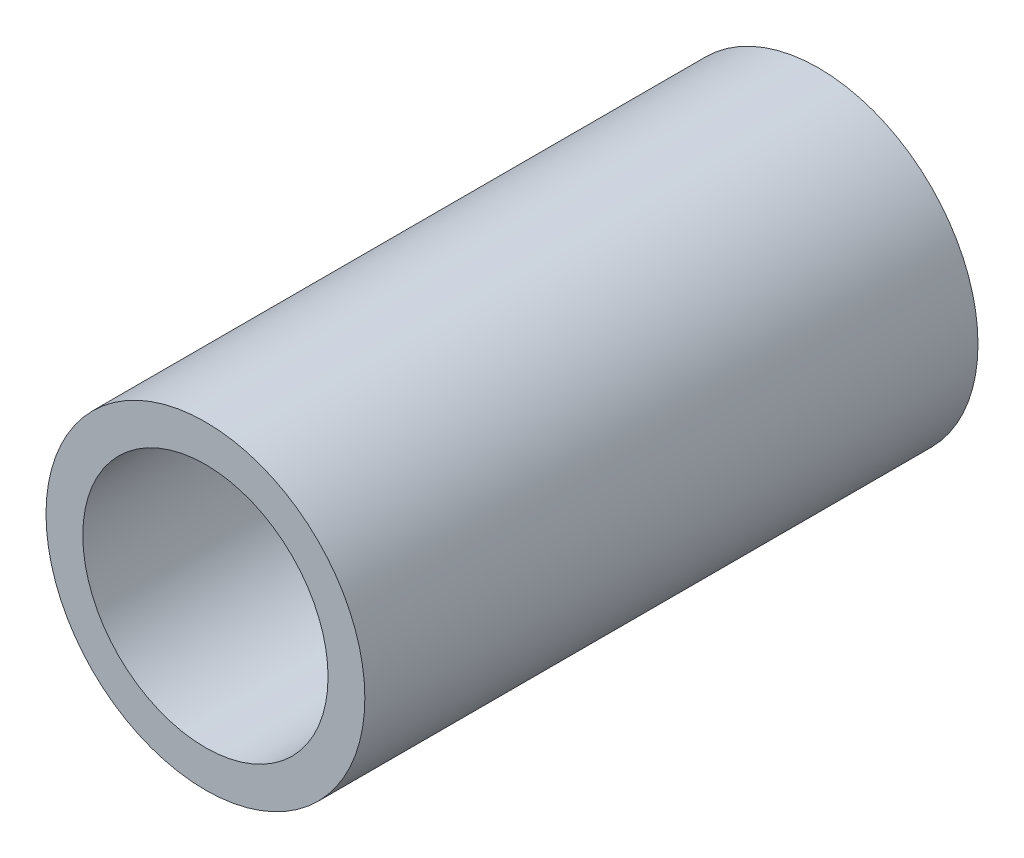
SolidWorks part; units mm, degrees
ref_plane "Płaszczyzna przednia" through (0, 0, 0) normal (0, 0, 1) x (1, 0, 0)
ref_plane "Płaszczyzna górna" through (0, 0, 0) normal (0, 1, 0) x (1, 0, 0)
ref_plane "Płaszczyzna prawa" through (0, 0, 0) normal (1, 0, 0) x (0, 0, -1)
sketch "Szkic1" plane through (0, 0, 0) normal (0, 0, 1) x (1, 0, 0)
  circle A0 centre (0, 0) radius 10
  circle A1 centre (0, 0) radius 13
  dimension "D1" = 20
  dimension "D2" = 26
extrude "Dodanie-wyciągnięcie1" add sketch "Szkic1" along normal blind 50
